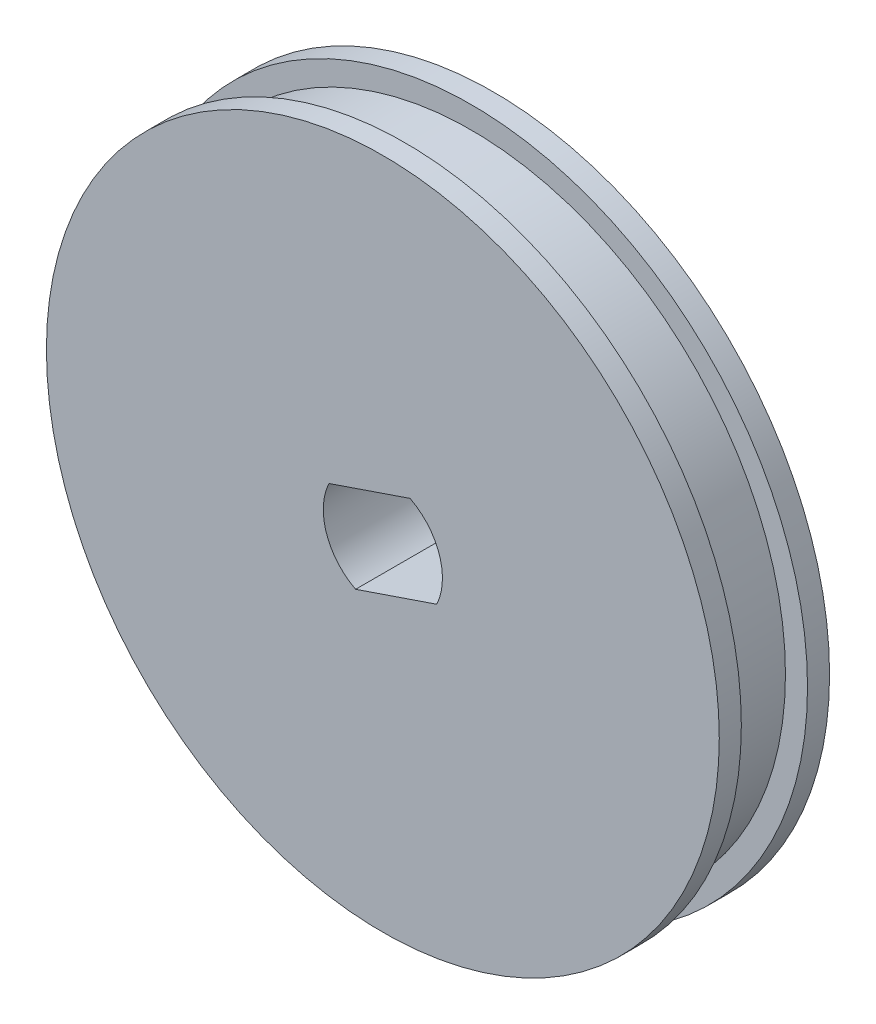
SolidWorks part; units mm, degrees
ref_plane "前视基准面" through (0, 0, 0) normal (0, 0, 1) x (1, 0, 0)
ref_plane "上视基准面" through (0, 0, 0) normal (0, 1, 0) x (1, 0, 0)
ref_plane "右视基准面" through (0, 0, 0) normal (1, 0, 0) x (0, 0, -1)
sketch "草图1" plane through (0, 0, 0) normal (0, 0, 1) x (1, 0, 0)
  circle A0 centre (22.4165, -13.7077) radius 14.25
  dimension "D1" = 28.5
extrude "凸台-拉伸1" add sketch "草图1" along normal mid plane 3
sketch "草图2" plane through (0, 0, 1.5) normal (0, 0, 1) x (1, 0, 0)
  circle A2 centre (22.4165, -13.7077) radius 15.25
  circle A3 centre (22.4165, -13.7077) radius 15.25
  dimension "D1" = 1
extrude "凸台-拉伸2" add sketch "草图2" along normal blind 1
mirror "镜向1" about plane through (0, 0, 0) normal (0, 0, 1) of "凸台-拉伸2"
sketch "草图3" plane through (0, 0, 2.5) normal (0, 0, 1) x (1, 0, 0)
  line L0 (23.6511, -11.3064) -> (19.973, -12.5592) construction
  line L1 (21.182, -16.1089) -> (24.8601, -14.8562) construction
  line L2 (23.6511, -11.3064) -> (19.973, -12.5592)
  line L3 (21.182, -16.1089) -> (24.8601, -14.8562)
  arc A0 (19.973, -12.5592) -> (21.182, -16.1089) centre (22.4165, -13.7077) ccw construction
  arc A1 (24.8601, -14.8562) -> (23.6511, -11.3064) centre (22.4165, -13.7077) ccw construction
  arc A3 (19.973, -12.5592) -> (21.182, -16.1089) centre (22.4165, -13.7077) ccw
  arc A4 (24.8601, -14.8562) -> (23.6511, -11.3064) centre (22.4165, -13.7077) ccw
extrude "切除-拉伸1" cut sketch "草图3" against normal through all
